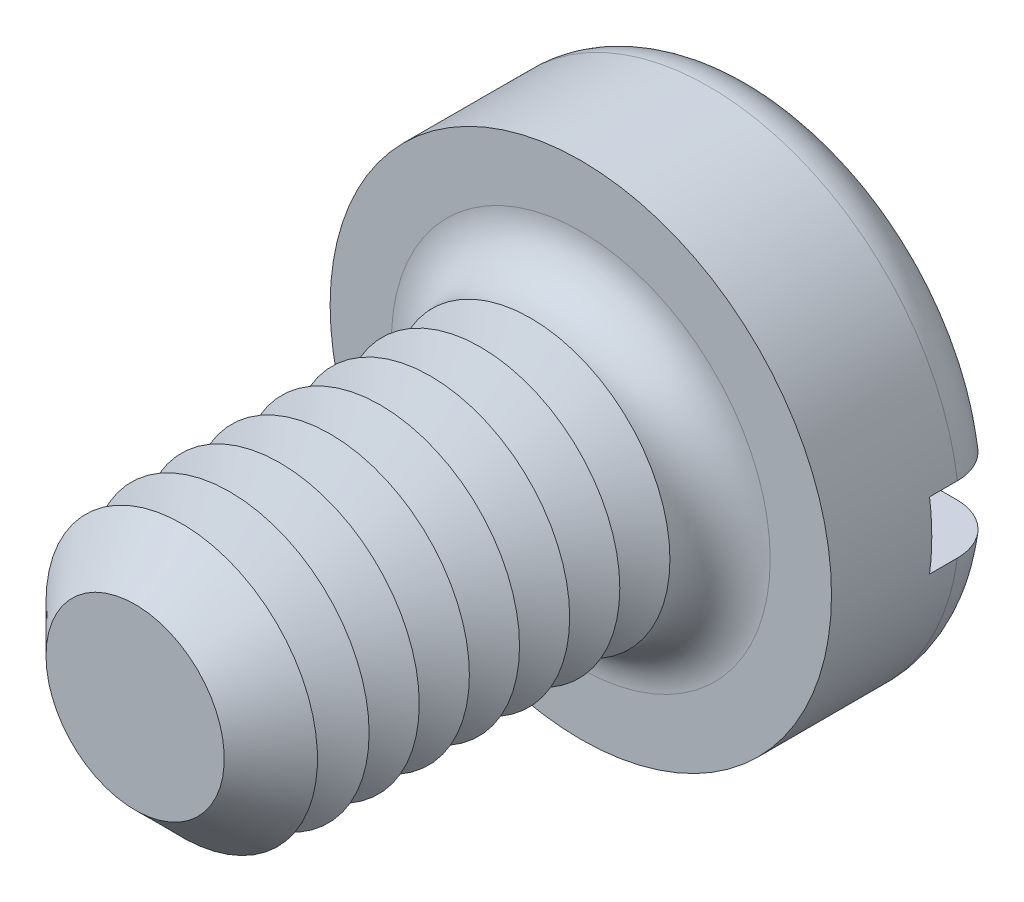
SolidWorks part; units mm, degrees
ref_plane "Front Plane" through (0, 0, 0) normal (0, 0, 1) x (1, 0, 0)
ref_plane "Top Plane" through (0, 0, 0) normal (0, 1, 0) x (1, 0, 0)
ref_plane "Right Plane" through (0, 0, 0) normal (1, 0, 0) x (0, 0, -1)
sketch "Sketch3" plane through (0, 0, 0) normal (0, 0, 1) x (1, 0, 0)
  circle A0 centre (0, 0) radius 2.25
  dimension "D1" = 4.5
extrude "Boss-Extrude2" add sketch "Sketch3" against normal blind 1.6
sketch "Sketch4" plane through (0, 0, 0) normal (0, 0, 1) x (1, 0, 0)
  circle A0 centre (0, 0) radius 1.25
  dimension "D1" = 2.5
extrude "Boss-Extrude3" add sketch "Sketch4" along normal blind 4
fillet "Fillet1" radius 0.45 2 edges at (2.25, 0, -1.6) (1.25, 0, 0)
chamfer "Chamfer1" distance 0.45 angle 45 1 edges at (1.25, 0, 4)
sketch "Sketch5" plane through (0, 0, 0) normal (1, 0, 0) x (0, 0, -1)
  line L0 (1.6944, 0) -> (-7.6738, 0) construction
sketch "Sketch6" plane through (0, 0, 0) normal (1, 0, 0) x (0, 0, -1)
  line L0 (-0.45, 1.25) -> (-0.675, 0.8603)
  line L1 (-0.675, 0.8603) -> (-0.9, 1.25)
  line L2 (-0.45, 1.25) -> (-3.55, 1.25) construction
  line L3 (-0.9, 1.25) -> (-0.45, 1.25)
  dimension "D1" = 0.45
revolve "Cut-Revolve1" cut sketch "Sketch6" angle 360 about L0
pattern_linear "LPattern1" count 7 spacing 0.45 along (0, 0, 1) of "Cut-Revolve1"
sketch "Sketch8" plane through (0, 0, -1.6) normal (0, 0, -1) x (-1, 0, 0)
  line L1 (2.25, -0.3) -> (-2.25, -0.3)
  line L2 (2.25, -0.3) -> (2.25, 0.3)
  line L3 (2.25, 0.3) -> (-2.25, 0.3)
  line L4 (-2.25, -0.3) -> (-2.25, 0.3)
  line L5 (2.25, -0.3) -> (-2.25, 0.3) construction
  line L6 (2.25, 0.3) -> (-2.25, -0.3) construction
  point P0 (0, 0)
  dimension "D1" = 4.5
  dimension "D2" = 0.6
extrude "Cut-Extrude1" cut sketch "Sketch8" against normal blind 0.7
